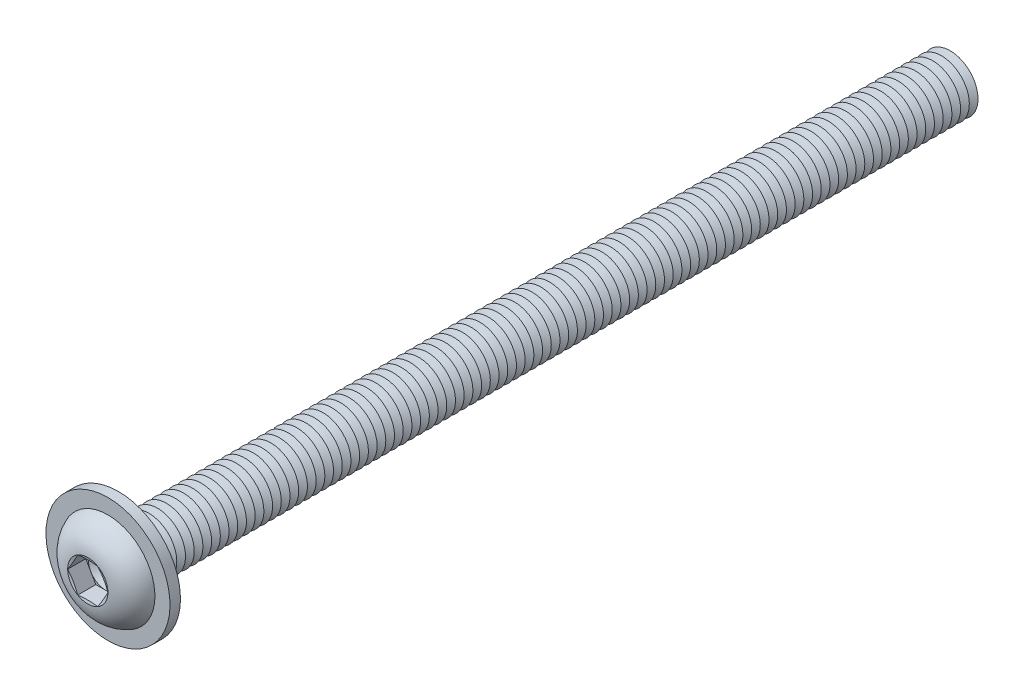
SolidWorks part; units mm, degrees
ref_plane "Front Plane" through (0, 0, 0) normal (0, 0, 1) x (1, 0, 0)
ref_plane "Top Plane" through (0, 0, 0) normal (0, 1, 0) x (1, 0, 0)
ref_plane "Right Plane" through (0, 0, 0) normal (1, 0, 0) x (0, 0, -1)
sketch "Sketch1" plane through (0, 0, 0) normal (1, 0, 0) x (0, 0, -1)
  line L0 (0, 4) -> (0, 7)
  line L3 (0, 4) -> (120, 4)
  line L4 (120, 4) -> (120, 0)
  line L5 (120, 0) -> (-4.4, 0) construction
  line L6 (-4.4, 0) -> (120, 0)
  line L7 (-4.4, 2.8867) -> (-4.4, 1.4434) construction
  line L8 (-4.4, 1.4434) -> (-4.4, 0)
  line L9 (-4.4, 2.8867) -> (-4.0132, 1.4434)
  line L10 (-4.0132, 1.4434) -> (-4.4, 1.4434)
  line L11 (120, 0) -> (22.7481, 0) construction
  line L12 (0, 7) -> (-4.4, 7) construction
  arc A1 (0, 7) -> (-4.4, 2.8867) centre (0, 2.59) ccw
  point P8 (120, 2)
  dimension "D1" = 14
  dimension "D2" = 8
  dimension "D3" = 4.4
  dimension "D4" = 5.7735
  dimension "D5" = 120
  dimension "D6" = 15
revolve "Revolve1" add sketch "Sketch1" angle 360 about L5
fillet "Fillet1" radius 0.625 1 edges at (0, 4, 0)
sketch "Sketch2" plane through (0, 0, 0) normal (1, 0, 0) x (0, 0, -1)
  line L0 (119.375, 4) -> (120.625, 4)
  line L1 (120, 4) -> (0.625, 4) construction
  line L2 (120.625, 4) -> (120, 2.9175)
  line L3 (120, -4) -> (120, 4) construction
  line L4 (120, 2.9175) -> (119.375, 4)
  dimension "D1" = 1.25
revolve "Cut-Revolve1" cut sketch "Sketch2" angle 360 about axis through (0, 0, -120) along (0, 0, -1)
pattern_linear "LPattern1" count 96 spacing 1.25 along (0, 0, 1) of "Cut-Revolve1"
sketch "Sketch3" plane through (0, 0, 4.4) normal (0, 0, 1) x (1, 0, 0)
  line L7 (1.4434, 2.5) -> (-1.4434, 2.5)
  line L8 (-1.4434, 2.5) -> (-2.8867, 0)
  line L9 (-2.8867, 0) -> (-1.4434, -2.5)
  line L10 (-1.4434, -2.5) -> (1.4434, -2.5)
  line L11 (1.4434, -2.5) -> (2.8867, 0)
  line L12 (2.8867, 0) -> (1.4434, 2.5)
  circle A0 centre (0, 0) radius 2.5 construction
  circle A3 centre (0, 0) radius 2.8867 construction
extrude "Cut-Extrude1" cut sketch "Sketch3" against normal blind 2.6
sketch "Sketch4" plane through (0, 0, 1.8) normal (0, 0, 1) x (1, 0, 0)
  line L1 (1.4434, 2.5) -> (-1.4434, 2.5) construction
  circle A0 centre (0, 0) radius 2.5
extrude "Cut-Extrude2" cut sketch "Sketch4" against normal through all draft 60
sketch "Sketch5" plane through (0, 0, 0) normal (0, 0, -1) x (-1, 0, 0)
  circle A0 centre (0, 0) radius 8.9
  circle A1 centre (0, 0) radius 4.625
  circle A2 centre (0, 0) radius 4.625 construction
  dimension "D1" = 17.8
extrude "Boss-Extrude1" add sketch "Sketch5" against normal blind 1.5
